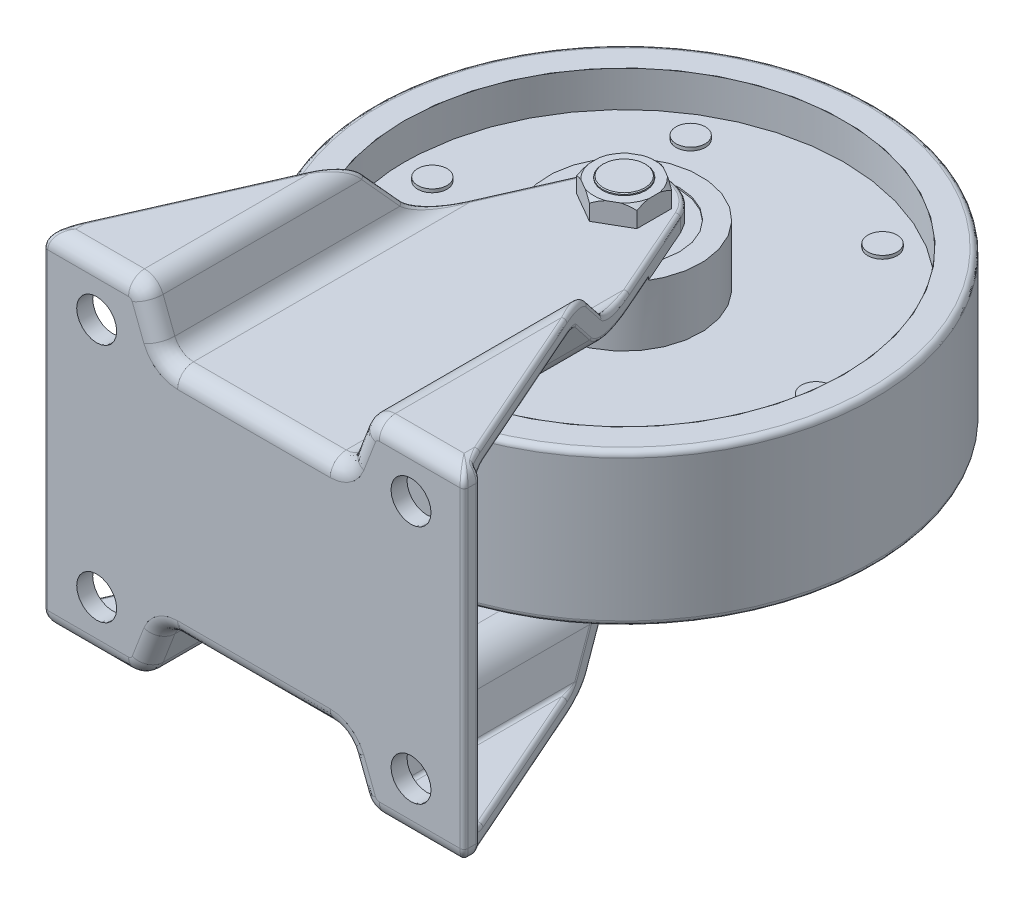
SolidWorks part; units mm, degrees
ref_plane "Front Plane" through (0, 0, 0) normal (0, 0, 1) x (1, 0, 0)
ref_plane "Top Plane" through (0, 0, 0) normal (0, 1, 0) x (1, 0, 0)
ref_plane "Right Plane" through (0, 0, 0) normal (1, 0, 0) x (0, 0, -1)
imported_body "Imported3"
sketch "Sketch1" plane through (0, 28, 0) normal (0, 1, 0) x (-1, 0, 0)
  line L0 (16.0239, 10.2095) -> (10.388, -2.5665)
  line L1 (-9.7901, -4.3187) -> (-16.1269, 10.0461)
  arc A0 (10.388, -2.5665) -> (-9.7901, -4.3187) centre (0, 0) cw
  arc A1 (-16.1269, 10.0461) -> (16.0239, 10.2095) centre (0, 0) ccw
extrude "Cut-Extrude1" cut sketch "Sketch1" against normal blind 2
sketch "Sketch2" plane through (0, -28, 0) normal (0, -1, 0) x (1, 0, 0)
  line L0 (16.1269, 10.0461) -> (9.7901, -4.3187)
  line L1 (-10.388, -2.5665) -> (-16.0239, 10.2095)
  arc A0 (9.7901, -4.3187) -> (-10.388, -2.5665) centre (0, 0) cw
  arc A1 (-16.0239, 10.2095) -> (16.1269, 10.0461) centre (0, 0) ccw
extrude "Cut-Extrude2" cut sketch "Sketch2" against normal blind 2
sketch "Sketch3" plane through (0, 26, 0) normal (0, 1, 0) x (-1, 0, 0)
  line L0 (16.0239, 10.2095) -> (10.388, -2.5665)
  line L1 (-9.7901, -4.3187) -> (-16.1269, 10.0461)
  arc A0 (10.388, -2.5665) -> (-9.7901, -4.3187) centre (0, 0) cw
  arc A1 (-16.1269, 10.0461) -> (16.0239, 10.2095) centre (0, 0) ccw
extrude "Cut-Extrude3" cut sketch "Sketch3" against normal blind 1
sketch "Sketch4" plane through (0, -26, 0) normal (0, -1, 0) x (1, 0, 0)
  line L0 (16.1269, 10.0461) -> (9.7901, -4.3187)
  line L1 (-10.388, -2.5665) -> (-16.0239, 10.2095)
  arc A0 (9.7901, -4.3187) -> (-10.388, -2.5665) centre (0, 0) cw
  arc A1 (-16.0239, 10.2095) -> (16.1269, 10.0461) centre (0, 0) ccw
extrude "Cut-Extrude4" cut sketch "Sketch4" against normal blind 1
ref_plane "Plane1" through (0, 0, -0.5392) normal (0, 0, -1) x (-1, 0, 0)
sketch "Sketch5" plane through (0, 0, -0.5392) normal (0, 0, -1) x (-1, 0, 0)
  line L0 (-51.0421, -10.8322) -> (-47.3731, -10.8322)
  line L1 (-47.3731, -10.8322) -> (-47.3731, -10)
  line L2 (-47.3731, -10) -> (-51.0421, -10)
  line L3 (-51.0421, -10) -> (-51.0421, -10.8322)
  line L4 (-47.3731, -10.8322) -> (-47.3731, -10) construction
revolve "Revolve1" add sketch "Sketch5" angle 360 about L4
sketch "Sketch6" plane through (0, 0, -0.5392) normal (0, 0, -1) x (-1, 0, 0)
  line L0 (-51.0421, 10) -> (-47.3731, 10)
  line L1 (-47.3731, 10) -> (-47.3731, 10.8322)
  line L2 (-47.3731, 10.8322) -> (-51.0421, 10.8322)
  line L3 (-51.0421, 10.8322) -> (-51.0421, 10)
  line L4 (-47.3731, 10) -> (-47.3731, 10.8322) construction
revolve "Revolve2" add sketch "Sketch6" angle 360 about L4
sketch "Sketch7" plane through (0, 0, 0) normal (0, 0, 1) x (1, 0, 0)
  line L0 (5.184, 34.5059) -> (0, 34.5059)
  line L1 (0, 34.5059) -> (0, 34.0215)
  line L2 (0, 34.0215) -> (5.409, 34.0215)
  line L3 (5.409, 34.0215) -> (5.409, 34.2809)
  line L4 (5.409, 34.2809) -> (5.184, 34.5059)
  line L5 (0, 34.5059) -> (0, 34.0215) construction
revolve "Revolve3" add sketch "Sketch7" angle 360 about L5
ref_plane "Plane2" through (0, 0, 0) normal (0, 0, -1) x (-1, 0, 0)
sketch "Sketch8" plane through (0, 0, 0) normal (0, 0, -1) x (-1, 0, 0)
  line L0 (-13.8561, 24.6024) -> (0, 24.6024)
  line L1 (0, 24.6024) -> (0, 25)
  line L2 (0, 25) -> (-13.8561, 25)
  line L3 (-13.8561, 25) -> (-13.8561, 24.6024)
  line L4 (0, 24.6024) -> (0, 25) construction
revolve "Cut-Revolve1" cut sketch "Sketch8" angle 360 about L4
sketch "Sketch9" plane through (0, 0, 0) normal (0, 0, 1) x (1, 0, 0)
  line L0 (13.8561, -24.7105) -> (0, -24.7105)
  line L1 (0, -24.7105) -> (0, -25)
  line L2 (0, -25) -> (13.8561, -25)
  line L3 (13.8561, -25) -> (13.8561, -24.7105)
  line L4 (0, -24.7105) -> (0, -25) construction
revolve "Cut-Revolve2" cut sketch "Sketch9" angle 360 about L4
ref_plane "Plane3" through (0, -30, 0) normal (0, -1, 0) x (1, 0, 0)
sketch "Sketch10" plane through (0, -30, 0) normal (0, -1, 0) x (1, 0, 0)
  line L0 (-34.2915, 92.5001) -> (-39.25, 92.5001)
  line L1 (-39.25, 92.5001) -> (-39.25, 88.5001)
  line L2 (-39.25, 88.5001) -> (-34.7915, 88.5001)
  line L3 (-34.7915, 88.5001) -> (-34.7915, 92.0001)
  line L4 (-34.7915, 92.0001) -> (-34.2915, 92.5001)
  line L5 (-39.25, 92.5001) -> (-39.25, 88.5001) construction
revolve "Cut-Revolve3" cut sketch "Sketch10" angle 360 about L5
sketch "Sketch11" plane through (0, -30, 0) normal (0, -1, 0) x (1, 0, 0)
  line L0 (44.2085, 92.5001) -> (39.25, 92.5001)
  line L1 (39.25, 92.5001) -> (39.25, 88.5001)
  line L2 (39.25, 88.5001) -> (43.7085, 88.5001)
  line L3 (43.7085, 88.5001) -> (43.7085, 92.0001)
  line L4 (43.7085, 92.0001) -> (44.2085, 92.5001)
  line L5 (39.25, 92.5001) -> (39.25, 88.5001) construction
revolve "Cut-Revolve4" cut sketch "Sketch11" angle 360 about L5
ref_plane "Plane4" through (0, 30, 0) normal (0, -1, 0) x (1, 0, 0)
sketch "Sketch12" plane through (0, 30, 0) normal (0, -1, 0) x (1, 0, 0)
  line L0 (44.2085, 92.5001) -> (39.25, 92.5001)
  line L1 (39.25, 92.5001) -> (39.25, 88.5001)
  line L2 (39.25, 88.5001) -> (43.7085, 88.5001)
  line L3 (43.7085, 88.5001) -> (43.7085, 92.0001)
  line L4 (43.7085, 92.0001) -> (44.2085, 92.5001)
  line L5 (39.25, 92.5001) -> (39.25, 88.5001) construction
revolve "Cut-Revolve5" cut sketch "Sketch12" angle 360 about L5
sketch "Sketch13" plane through (0, 30, 0) normal (0, -1, 0) x (1, 0, 0)
  line L0 (-34.2915, 92.5001) -> (-39.25, 92.5001)
  line L1 (-39.25, 92.5001) -> (-39.25, 88.5001)
  line L2 (-39.25, 88.5001) -> (-34.7915, 88.5001)
  line L3 (-34.7915, 88.5001) -> (-34.7915, 92.0001)
  line L4 (-34.7915, 92.0001) -> (-34.2915, 92.5001)
  line L5 (-39.25, 92.5001) -> (-39.25, 88.5001) construction
revolve "Cut-Revolve6" cut sketch "Sketch13" angle 360 about L5
ref_plane "Plane5" through (0, 0, 40.7567) normal (0, 0, -1) x (-1, 0, 0)
sketch "Sketch14" plane through (0, 0, 40.7567) normal (0, 0, -1) x (-1, 0, 0)
  line L0 (-27.8225, -10.8322) -> (-24.1535, -10.8322)
  line L1 (-24.1535, -10.8322) -> (-24.1535, -10)
  line L2 (-24.1535, -10) -> (-27.8225, -10)
  line L3 (-27.8225, -10) -> (-27.8225, -10.8322)
  line L4 (-24.1535, -10.8322) -> (-24.1535, -10) construction
revolve "Revolve4" add sketch "Sketch14" angle 360 about L4
sketch "Sketch15" plane through (0, 0, 40.7567) normal (0, 0, -1) x (-1, 0, 0)
  line L0 (-27.8225, 10) -> (-24.1535, 10)
  line L1 (-24.1535, 10) -> (-24.1535, 10.8322)
  line L2 (-24.1535, 10.8322) -> (-27.8225, 10.8322)
  line L3 (-27.8225, 10.8322) -> (-27.8225, 10)
  line L4 (-24.1535, 10) -> (-24.1535, 10.8322) construction
revolve "Revolve5" add sketch "Sketch15" angle 360 about L4
ref_plane "Plane6" through (0, 0, 41.2959) normal (0, 0, -1) x (-1, 0, 0)
sketch "Sketch16" plane through (0, 0, 41.2959) normal (0, 0, -1) x (-1, 0, 0)
  line L0 (19.5506, -10.8322) -> (23.2196, -10.8322)
  line L1 (23.2196, -10.8322) -> (23.2196, -10)
  line L2 (23.2196, -10) -> (19.5506, -10)
  line L3 (19.5506, -10) -> (19.5506, -10.8322)
  line L4 (23.2196, -10.8322) -> (23.2196, -10) construction
revolve "Revolve6" add sketch "Sketch16" angle 360 about L4
sketch "Sketch17" plane through (0, 0, 41.2959) normal (0, 0, -1) x (-1, 0, 0)
  line L0 (19.5506, 10) -> (23.2196, 10)
  line L1 (23.2196, 10) -> (23.2196, 10.8322)
  line L2 (23.2196, 10.8322) -> (19.5506, 10.8322)
  line L3 (19.5506, 10.8322) -> (19.5506, 10)
  line L4 (23.2196, 10) -> (23.2196, 10.8322) construction
revolve "Revolve7" add sketch "Sketch17" angle 360 about L4
ref_plane "Plane7" through (0, 0, 0.5392) normal (0, 0, -1) x (-1, 0, 0)
sketch "Sketch18" plane through (0, 0, 0.5392) normal (0, 0, -1) x (-1, 0, 0)
  line L0 (43.7041, -10.8322) -> (47.3731, -10.8322)
  line L1 (47.3731, -10.8322) -> (47.3731, -10)
  line L2 (47.3731, -10) -> (43.7041, -10)
  line L3 (43.7041, -10) -> (43.7041, -10.8322)
  line L4 (47.3731, -10.8322) -> (47.3731, -10) construction
revolve "Revolve8" add sketch "Sketch18" angle 360 about L4
sketch "Sketch19" plane through (0, 0, 0.5392) normal (0, 0, -1) x (-1, 0, 0)
  line L0 (43.7041, 10) -> (47.3731, 10)
  line L1 (47.3731, 10) -> (47.3731, 10.8322)
  line L2 (47.3731, 10.8322) -> (43.7041, 10.8322)
  line L3 (43.7041, 10.8322) -> (43.7041, 10)
  line L4 (47.3731, 10) -> (47.3731, 10.8322) construction
revolve "Revolve9" add sketch "Sketch19" angle 360 about L4
ref_plane "Plane8" through (0, 0, -40.7567) normal (0, 0, -1) x (-1, 0, 0)
sketch "Sketch20" plane through (0, 0, -40.7567) normal (0, 0, -1) x (-1, 0, 0)
  line L0 (20.4845, -10.8322) -> (24.1535, -10.8322)
  line L1 (24.1535, -10.8322) -> (24.1535, -10)
  line L2 (24.1535, -10) -> (20.4845, -10)
  line L3 (20.4845, -10) -> (20.4845, -10.8322)
  line L4 (24.1535, -10.8322) -> (24.1535, -10) construction
revolve "Revolve10" add sketch "Sketch20" angle 360 about L4
sketch "Sketch21" plane through (0, 0, -40.7567) normal (0, 0, -1) x (-1, 0, 0)
  line L0 (20.4845, 10) -> (24.1535, 10)
  line L1 (24.1535, 10) -> (24.1535, 10.8322)
  line L2 (24.1535, 10.8322) -> (20.4845, 10.8322)
  line L3 (20.4845, 10.8322) -> (20.4845, 10)
  line L4 (24.1535, 10) -> (24.1535, 10.8322) construction
revolve "Revolve11" add sketch "Sketch21" angle 360 about L4
ref_plane "Plane9" through (0, 0, -41.2959) normal (0, 0, -1) x (-1, 0, 0)
sketch "Sketch22" plane through (0, 0, -41.2959) normal (0, 0, -1) x (-1, 0, 0)
  line L0 (-26.8886, -10.8322) -> (-23.2196, -10.8322)
  line L1 (-23.2196, -10.8322) -> (-23.2196, -10)
  line L2 (-23.2196, -10) -> (-26.8886, -10)
  line L3 (-26.8886, -10) -> (-26.8886, -10.8322)
  line L4 (-23.2196, -10.8322) -> (-23.2196, -10) construction
revolve "Revolve12" add sketch "Sketch22" angle 360 about L4
sketch "Sketch23" plane through (0, 0, -41.2959) normal (0, 0, -1) x (-1, 0, 0)
  line L0 (-26.8886, 10) -> (-23.2196, 10)
  line L1 (-23.2196, 10) -> (-23.2196, 10.8322)
  line L2 (-23.2196, 10.8322) -> (-26.8886, 10.8322)
  line L3 (-26.8886, 10.8322) -> (-26.8886, 10)
  line L4 (-23.2196, 10) -> (-23.2196, 10.8322) construction
revolve "Revolve13" add sketch "Sketch23" angle 360 about L4
fillet "Fillet1" radius 1 3 edges at (-52.5, 0, 92.5001)
fillet "Fillet2" radius 1.4 2 edges at (0, 19, -62.5) (0, -19, -62.5)
sketch "Sketch24" plane through (0, 0, 92.5001) normal (0, 0, 1) x (1, 0, 0)
  line L0 (68.75, 0) -> (-68.75, 0) construction
  line L1 (0, -48.3558) -> (0, 48.3558) construction
  circle A0 centre (-39.25, 30) radius 5
  circle A1 centre (-39.25, -30) radius 5
  circle A2 centre (39.25, -30) radius 5
  circle A3 centre (39.25, 30) radius 5
  dimension "D1" = 10
extrude "Cut-Extrude5" cut sketch "Sketch24" against normal blind 10
